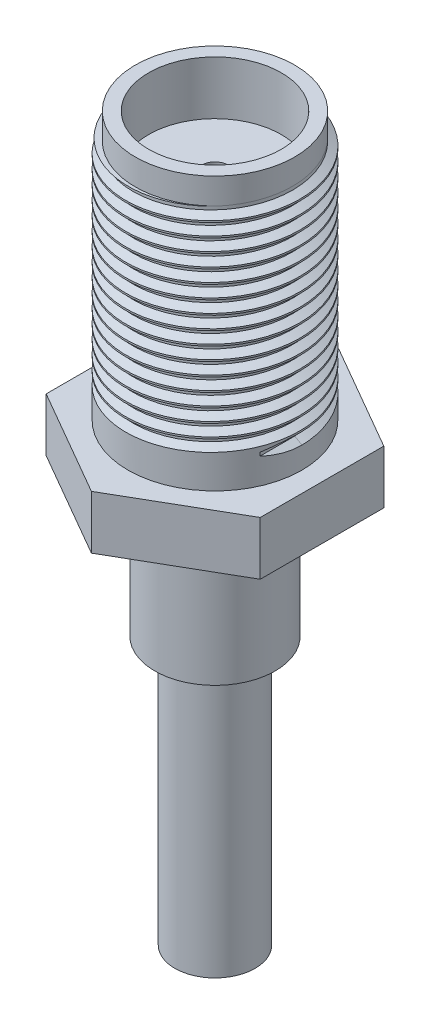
SolidWorks part; units mm, degrees
ref_plane "Front Plane" through (0, 0, 0) normal (0, 0, 1) x (1, 0, 0)
ref_plane "Top Plane" through (0, 0, 0) normal (0, 1, 0) x (1, 0, 0)
ref_plane "Right Plane" through (0, 0, 0) normal (1, 0, 0) x (0, 0, -1)
sketch "Эскиз1" plane through (0, 0, 0) normal (0, 1, 0) x (1, 0, 0)
  line L1 (0, 4.6188) -> (-4, 2.3094)
  line L2 (-4, 2.3094) -> (-4, -2.3094)
  line L3 (-4, -2.3094) -> (0, -4.6188)
  line L4 (0, -4.6188) -> (4, -2.3094)
  line L5 (4, -2.3094) -> (4, 2.3094)
  line L6 (4, 2.3094) -> (0, 4.6188)
  circle A0 centre (0, 0) radius 4 construction
  dimension "D1" = 8
extrude "Бобышка-Вытянуть1" add sketch "Эскиз1" along normal blind 2
sketch "Эскиз2" plane through (0, 2, 0) normal (0, 1, 0) x (1, 0, 0)
  circle A0 centre (0, 0) radius 3.25
  dimension "D1" = 6.5
extrude "Бобышка-Вытянуть2" add sketch "Эскиз2" along normal blind 10
thread "Резьба1" pitch 0.5 start angle 0, offset 0.5, length 0, pitch 0.5, diameter 6.5
ref_plane "Плоскость1" through (-3.25, 11.5, 0) normal (0, 0, 1) x (-1, 0, 0)
sketch "Профиль резьбы1" plane through (-3.25, 11.5, 0) normal (0, 0, 1) x (-1, 0, 0)
  line L0 (0, 0) -> (0, 0.5) construction
  line L11 (0, 0) -> (0, 0.4375)
  line L12 (0, 0.4375) -> (-0.2706, 0.2812)
  line L13 (-0.2706, 0.2812) -> (-0.2706, 0.1562)
  line L15 (-0.2706, 0.1562) -> (0, 0)
  line L17 (-0.2706, 0.2187) -> (0, 0.2187) construction
  point P2 (0, 0)
  dimension "Pitch" = 0.5
  dimension "Profile_Angle" = 60
  dimension "Profile_Land" = 0.125
  dimension "Profile_Height" = 0.2706
sketch "Эскиз6" plane through (0, 0, 0) normal (0, 0, 1) x (1, 0, 0)
  line L1 (-3.5962, 12.0975) -> (-3.0016, 12.0975)
  line L2 (-3.5962, 12.0975) -> (-3.5962, 2.3096)
  line L3 (-3.5962, 2.3096) -> (-3.0016, 2.3096)
  line L4 (-3.0016, 12.0975) -> (-3.0016, 2.3096)
extrude "Вырез-Вытянуть1" cut sketch "Эскиз6" against normal through all both and the other way through all
sketch "Эскиз7" plane through (0, 0, 0) normal (0, 0, 1) x (1, 0, 0)
  line L0 (2.9794, 10.9688) -> (2.9794, 11.0938) construction
  line L1 (3.25, 12) -> (2.9794, 12)
  line L2 (3.25, 12) -> (3.25, 11.0313)
  line L3 (3.25, 11.0313) -> (2.9794, 11.0313)
  line L4 (2.9794, 12) -> (2.9794, 11.0313)
  line L5 (0, 0) -> (0, 13.5818) construction
revolve "Вырез-Повернуть1" cut sketch "Эскиз7" angle 360 about L5
sketch "Эскиз8" plane through (0, 12, 0) normal (0, 1, 0) x (1, 0, 0)
  circle A0 centre (0, 0) radius 2.4794
  circle A1 centre (0, 0) radius 2.9794 construction
  dimension "D1" = 0.5
extrude "Вырез-Вытянуть2" cut sketch "Эскиз8" against normal blind 2
sketch "Эскиз9" plane through (0, 10, 0) normal (0, 1, 0) x (1, 0, 0)
  circle A0 centre (0, 0) radius 0.5
  dimension "D1" = 1
extrude "Вырез-Вытянуть3" cut sketch "Эскиз9" against normal through all
sketch "Эскиз10" plane through (0, 0, 0) normal (0, -1, 0) x (1, 0, 0)
  circle A0 centre (0, 0) radius 2
extrude "Вырез-Вытянуть4" cut sketch "Эскиз10" against normal blind 6
thread "Резьба2" pitch 0.5 start angle 0, offset 0, length 0, pitch 0.5, diameter 4
ref_plane "Плоскость2" through (2, 0, 0) normal (0, 0, 1) x (1, 0, 0)
sketch "Профиль резьбы2" plane through (2, 0, 0) normal (0, 0, 1) x (1, 0, 0)
  line L0 (0, 0) -> (0, 0.5) construction
  line L11 (0, 0) -> (0, 0.4375)
  line L12 (0, 0.4375) -> (-0.2706, 0.2812)
  line L13 (-0.2706, 0.2812) -> (-0.2706, 0.1562)
  line L15 (-0.2706, 0.1562) -> (0, 0)
  line L17 (-0.2706, 0.2187) -> (0, 0.2187) construction
  point P2 (0, 0)
  dimension "Pitch" = 0.5
  dimension "Profile_Angle" = 60
  dimension "Profile_Land" = 0.125
  dimension "Profile_Height" = 0.2706
sketch "Эскиз11" plane through (0, 0, 0) normal (0, 0, 1) x (1, 0, 0)
  line L4 (1.7294, 0.1562) -> (2, 0)
  line L5 (2, 0) -> (2, 0.4375)
  line L6 (2, 0.4375) -> (1.7294, 0.2812)
  line L7 (1.7294, 0.2812) -> (1.7294, 0.1562)
  line L8 (1.7294, 0.1562) -> (2, 0)
  line L9 (2, 0) -> (2, 0.4375)
  line L10 (2, 0.4375) -> (1.7294, 0.2812)
  line L11 (1.7294, 0.2812) -> (1.7294, 0.1562)
  dimension "D1" = 0
extrude "Бобышка-Вытянуть3" add sketch "Эскиз11" along normal up to surface
sketch "Эскиз12" plane through (0, 0, 0) normal (0, 0, -1) x (-1, 0, 0)
  line L4 (-2.9794, 3.0938) -> (-3.25, 3.25)
  line L5 (-3.25, 3.25) -> (-3.25, 2.8125)
  line L6 (-3.25, 2.8125) -> (-2.9794, 2.9688)
  line L7 (-2.9794, 2.9688) -> (-2.9794, 3.0938)
  line L8 (-2.9794, 3.0938) -> (-3.25, 3.25)
  line L9 (-3.25, 3.25) -> (-3.25, 2.8125)
  line L10 (-3.25, 2.8125) -> (-2.9794, 2.9688)
  line L11 (-2.9794, 2.9688) -> (-2.9794, 3.0938)
  dimension "D1" = 0
extrude "Вырез-Вытянуть5" cut sketch "Эскиз12" against normal through all
sketch "Sketch3" plane through (0, 0, 0) normal (1, 0, 0) x (0, 0, -1)
  line L0 (-2.25, 0) -> (-2.25, -5)
  line L1 (-4.6188, 0) -> (-2.3094, 0) construction
  line L2 (-2.25, -5) -> (-1.5, -5)
  line L3 (-1.5, -5) -> (-1.5, -15)
  line L4 (-1.5, -15) -> (0, -15)
  line L5 (0, -15) -> (0, 0)
  line L6 (0, 0) -> (-2.25, 0)
  dimension "D1" = 5
  dimension "D2" = 2.25
  dimension "D3" = 1.5
  dimension "D4" = 10
revolve "Revolve1" add sketch "Sketch3" angle 360 about L5
